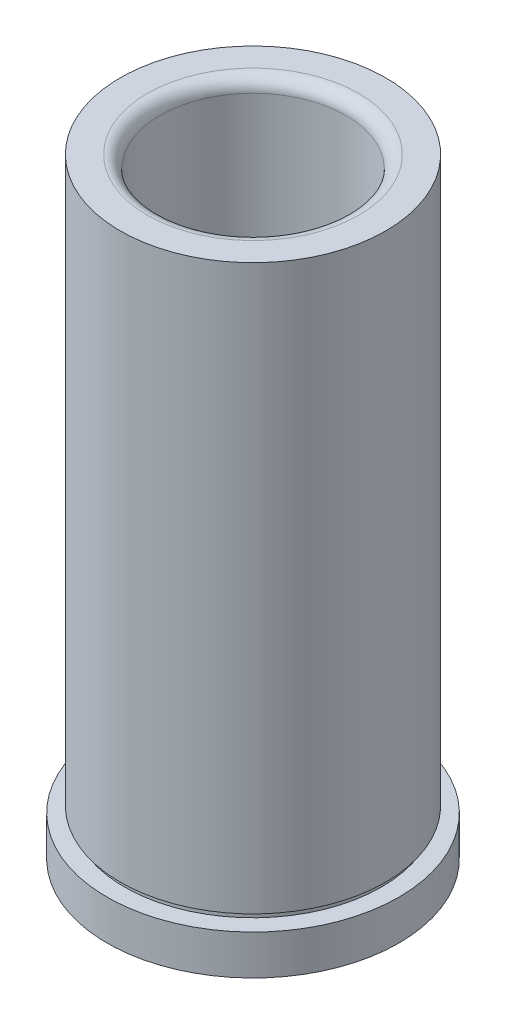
SolidWorks part; units mm, degrees
ref_plane "Front Plane" through (0, 0, 0) normal (0, 0, 1) x (1, 0, 0)
ref_plane "Top Plane" through (0, 0, 0) normal (0, 1, 0) x (1, 0, 0)
ref_plane "Right Plane" through (0, 0, 0) normal (1, 0, 0) x (0, 0, -1)
sketch "Sketch1" plane through (0, 0, 0) normal (0, 0, 1) x (1, 0, 0)
  line L0 (-736.3938, 0) -> (49263.6062, 0) construction
  line L1 (0, -1000) -> (0, 49000) construction
  line L2 (-11.1189, 73.025) -> (-11.1188, 28.575)
  line L4 (-17.4625, 0) -> (-17.4625, 4.7625)
  line L5 (-17.4625, 4.7625) -> (-15.3733, 4.7625)
  line L6 (-15.8814, 73.025) -> (-15.8813, 5.5245)
  line L7 (-15.8814, 73.025) -> (-11.1189, 73.025)
  line L8 (-12.3888, 27.305) -> (-12.3888, 0.7938)
  line L10 (-15.8813, 5.5245) -> (-15.3733, 5.5245)
  line L11 (-15.3733, 5.5245) -> (-15.3733, 4.7625)
  line L12 (-12.3888, 0.7938) -> (-13.1826, 0)
  line L13 (-13.1826, 0) -> (-17.4625, 0)
  arc A0 (-11.1188, 28.575) -> (-12.3888, 27.305) centre (-11.1188, 27.305) ccw
  dimension "D1" = 0.508
  dimension "OD" = 31.7627
  dimension "ID" = 22.2377
  dimension "FLANGETHICKNESS" = 4.7625
  dimension "FLANGEDIA" = 34.925
  dimension "D2" = 1.27
  dimension "D3" = 0.762
  dimension "D4" = 45
  dimension "D5" = 0.7937
  dimension "D6" = 73.025
  dimension "D7" = 44.45
revolve "Revolve1" add sketch "Sketch1" angle 360 about L1
fillet "Fillet1" radius 1.524 1 edges at (11.1188, 73.025, 0)
